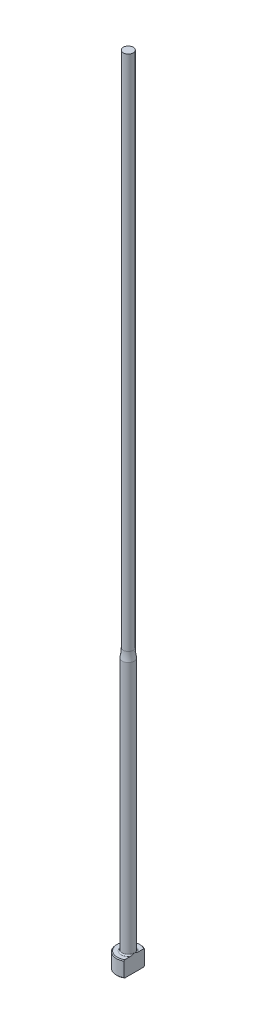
SolidWorks part; units mm, degrees
ref_plane "Front Plane" through (0, 0, 0) normal (0, 0, 1) x (1, 0, 0)
ref_plane "Top Plane" through (0, 0, 0) normal (0, 1, 0) x (1, 0, 0)
ref_plane "Right Plane" through (0, 0, 0) normal (1, 0, 0) x (0, 0, -1)
sketch "Sketch1" plane through (0, 0, 0) normal (0, 0, 1) x (1, 0, 0)
  line L0 (0, 259.9588) -> (0, -15.1925) construction
  line L1 (0, 0) -> (-3, 0)
  line L2 (-3, 0) -> (-3, 4)
  line L3 (-3, 4) -> (-1.5, 4)
  line L4 (-1.25, 70) -> (-1.25, 200)
  line L5 (-1.25, 200) -> (0, 200)
  line L6 (0, 200) -> (0, 0)
  line L7 (-1.5, 4) -> (-1.5, 67.778)
  arc A0 (-1.5, 67.778) -> (-1.25, 70) centre (-11.25, 70) ccw
  point P13 (-1.5, 0)
  dimension "D1" = 10
  dimension "L" = 200
  dimension "H" = 6
  dimension "T" = 4
  dimension "D" = 2.5
  dimension "B" = 3
  dimension "S" = 70
revolve "Revolve1" add sketch "Sketch1" angle 360 about L0
chamfer "Chamfer1" distance 0.2 angle 45 2 edges at (0, 4, 3) (0, 0, 3)
fillet "Fillet1" radius 0.3 1 edges at (0, 4, 1.5)
sketch "Sketch2" plane through (0, 0, 0) normal (0, 1, 0) x (1, 0, 0)
  line L0 (1.5, -2.5981) -> (1.5, 2.5981)
  circle A0 centre (0, 0) radius 3 construction
  arc A1 (1.5, -2.5981) -> (1.5, 2.5981) centre (0, 0) ccw
  circle A2 centre (0, 0) radius 1.5 construction
extrude "Keyed Head" cut sketch "Sketch2" along normal through all
